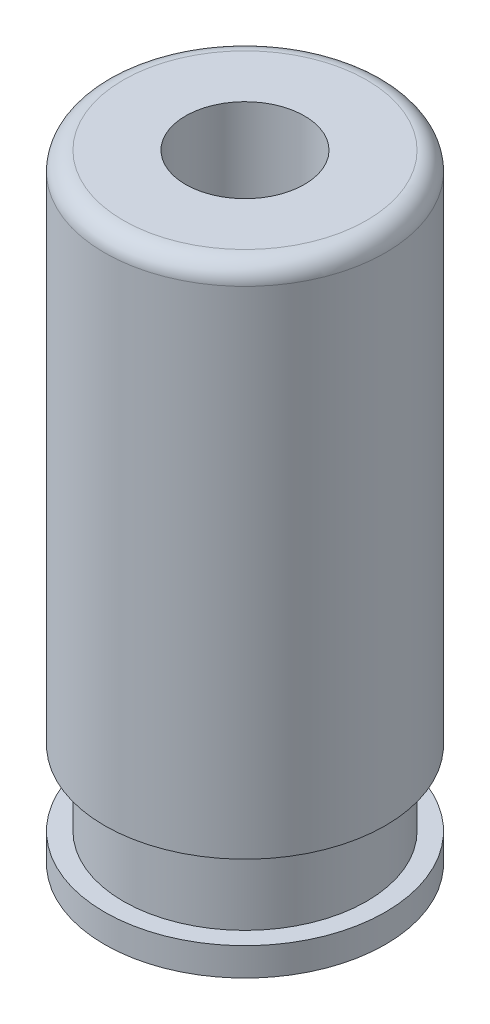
SolidWorks part; units mm, degrees
ref_plane "Front Plane" through (0, 0, 0) normal (0, 0, 1) x (1, 0, 0)
ref_plane "Top Plane" through (0, 0, 0) normal (0, 1, 0) x (1, 0, 0)
ref_plane "Right Plane" through (0, 0, 0) normal (1, 0, 0) x (0, 0, -1)
sketch "Sketch1" plane through (0, 0, 0) normal (0, 1, 0) x (1, 0, 0)
  circle A0 centre (0, 0) radius 7.5
extrude "Boss-Extrude1" add sketch "Sketch1" along normal blind 33
sketch "Sketch2" plane through (0, 0, 0) normal (0, 0, 1) x (1, 0, 0)
  line L0 (-7.5, 33) -> (-7.5, 0) construction
  line L1 (-8.5, 1.5) -> (-6.5, 1.5)
  line L2 (-8.5, 1.5) -> (-8.5, 5.5)
  line L3 (-8.5, 5.5) -> (-6.5, 5.5)
  line L4 (-6.5, 1.5) -> (-6.5, 5.5)
  line L5 (-8.5, 1.5) -> (-6.5, 5.5) construction
  line L6 (-8.5, 5.5) -> (-6.5, 1.5) construction
  line L7 (-7.5, 0) -> (7.5, 0) construction
  point P0 (-7.5, 3.5)
  dimension "D1" = 3.5
  dimension "D2" = 2
  dimension "D3" = 4
ref_axis "Axis1" through (0, 33, 0) along (0, -1, 0)
revolve "Cut-Revolve1" cut sketch "Sketch2" angle 360 about axis through (0, 33, 0) along (0, -1, 0)
sketch "Sketch3" plane through (0, 33, 0) normal (0, 1, 0) x (1, 0, 0)
  circle A0 centre (0, 0) radius 3.175
  dimension "D1" = 6.35
extrude "Cut-Extrude1" cut sketch "Sketch3" against normal blind 5
ref_plane "Plane1" through (0, 11, 0) normal (0, 1, 0) x (-1, 0, 0)
fillet "Fillet1" radius 1 1 edges at (0, 33, 7.5)
